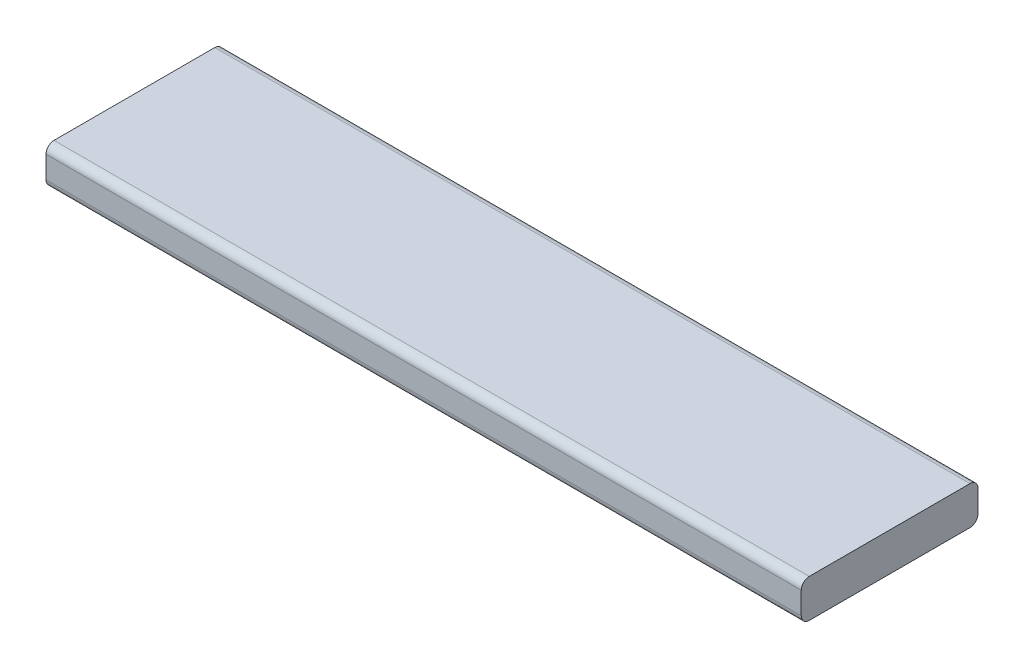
SolidWorks part; units mm, degrees
ref_plane "Bottom Plane" through (0, 0, 0) normal (0, 0, 1) x (1, 0, 0)
ref_plane "Front Plane" through (0, 0, 0) normal (0, 1, 0) x (1, 0, 0)
ref_plane "Left Plane" through (0, 0, 0) normal (1, 0, 0) x (0, 0, -1)
ref_plane "Right Plane" through (596.9, 0, 0) normal (1, 0, 0) x (0, 0, -1)
ref_plane "Back Plane" through (0, 19.05, 0) normal (0, 1, 0) x (1, 0, 0)
ref_plane "Top Plane" through (0, 0, 139.7) normal (0, 0, 1) x (1, 0, 0)
sketch "Sketch2" plane through (0, 0, 0) normal (1, 0, 0) x (0, 0, -1)
  line L1 (0, 0) -> (-139.7, 0)
  line L2 (0, 0) -> (0, 30.1625)
  line L3 (0, 30.1625) -> (-139.7, 30.1625)
  line L4 (-139.7, 0) -> (-139.7, 30.1625)
  dimension "D1" = 30.1625
  dimension "D2" = 139.7
extrude "Boss-Extrude1" add sketch "Sketch2" along normal up to surface (596.9 mm away)
ref_plane "half length" through (298.45, 0, 0) normal (1, 0, 0) x (0, 0, -1)
ref_plane "Half Width" through (0, 0, 69.85) normal (0, 0, 1) x (1, 0, 0)
fillet "Fillet1" radius 6.35 4 edges at (298.45, 30.1625, 139.7) (298.45, 30.1625, 0) (298.45, 0, 0) (298.45, 0, 139.7)
